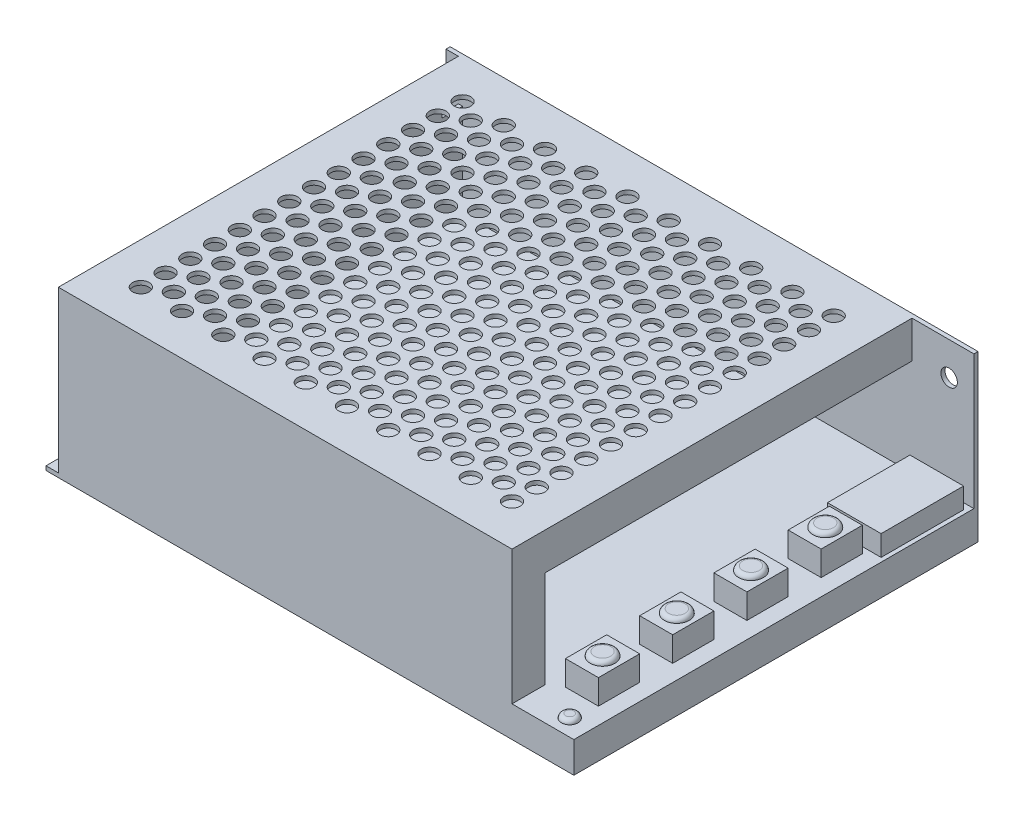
SolidWorks part; units mm, degrees
ref_plane "前视基准面" through (0, 0, 0) normal (0, 0, 1) x (1, 0, 0)
ref_plane "上视基准面" through (0, 0, 0) normal (0, 1, 0) x (1, 0, 0)
ref_plane "右视基准面" through (0, 0, 0) normal (1, 0, 0) x (0, 0, -1)
sketch "草图1" plane through (0, 0, 0) normal (1, 0, 0) x (0, 0, -1)
  line L2 (49, 20) -> (49, -20)
  line L3 (49, -20) -> (-49, -20)
  line L4 (-49, -20) -> (-49, 20)
  line L5 (-49, 20) -> (49, 20)
extrude "凸台-拉伸1" add sketch "草图1" along normal blind 110
ref_plane "基准面1" through (0, -20, 0) normal (0, 1, 0) x (1, 0, 0)
sketch "草图2" plane through (0, -20, 0) normal (0, 1, 0) x (1, 0, 0)
  line L0 (110, -49) -> (125, -49)
  line L1 (125, -49) -> (125, 48)
  line L2 (110, -49) -> (110, 48)
  line L3 (110, -49) -> (110, 49) construction
  line L4 (125, 48) -> (110, 48)
extrude "凸台-拉伸2" add sketch "草图2" along normal blind 7.5
sketch "草图3" plane through (0, -20, 0) normal (0, 1, 0) x (1, 0, 0)
  line L0 (110, 48) -> (110, 49)
  line L1 (110, 49) -> (125, 49)
  line L2 (125, 49) -> (125, 48)
  line L3 (125, 48) -> (110, 48)
extrude "凸台-拉伸3" add sketch "草图3" along normal blind 40
sketch "草图4" plane through (0, -20, 0) normal (0, 1, 0) x (1, 0, 0)
  line L0 (0, 49) -> (0, 48)
  line L1 (0, -49) -> (0, 49) construction
  line L2 (0, -49) -> (0, -36)
  line L3 (0, 48) -> (0, -36)
  line L4 (0, 48) -> (-3, 48)
  line L5 (-3, 48) -> (-3, -36)
  line L6 (-3, -36) -> (0, -36)
extrude "凸台-拉伸4" add sketch "草图4" along normal blind 13 contours L5 L6 L3 L4
sketch "草图5" plane through (0, -20, 0) normal (0, 1, 0) x (1, 0, 0)
  line L0 (0, 49) -> (0, 48)
  line L1 (0, 48) -> (-3, 48)
  line L2 (-3, 48) -> (-3, 49)
  line L3 (-3, 49) -> (0, 49)
sketch "草图6" plane through (0, 0, -48) normal (0, 0, -1) x (-1, 0, 0)
  line L0 (0.6022, -7) -> (3, -7)
  line L1 (0, -7) -> (3, -7) construction
  line L2 (3, -7) -> (3, -10.5)
  line L3 (3, -7) -> (3, -20) construction
  line L4 (0.6022, -7) -> (3, -10.5)
extrude "切除-拉伸2" cut sketch "草图6" against normal blind 84
extrude "凸台-拉伸6" add sketch "草图5" along normal blind 40
sketch "草图7" plane through (0, 0, 0) normal (-1, 0, 0) x (0, 0, 1)
  line L0 (49, -20) -> (36, -20)
  line L1 (36, -20) -> (36, -19)
  line L2 (36, -19) -> (49, -19)
  line L3 (49, 20) -> (49, -20) construction
  line L4 (49, -19) -> (49, -20)
extrude "凸台-拉伸7" add sketch "草图7" along normal blind 3
sketch "草图8" plane through (0, -19, 0) normal (0, 1, 0) x (1, 0, 0)
  line L1 (-2.5, -41.4979) -> (-1.5021, -41.4969)
  line L2 (-3, -49) -> (-3, -36) construction
  line L4 (-3, -36) -> (-3, -43.5015)
  line L5 (-3, -43.5015) -> (-1.5, -43.5031)
  line L7 (-3, -36) -> (-2.5, -36)
  line L8 (-3, -36) -> (0, -36) construction
  line L9 (-2.5, -36) -> (-2.5, -41.4979)
  arc A0 (-1.5021, -43.5031) -> (-1.5021, -41.4969) centre (-1.5, -42.5) ccw
sketch "草图11" plane through (0, 0, -48) normal (0, 0, 1) x (1, 0, 0)
  line L0 (-1.5, 12.0685) -> (-3, 12.0685)
  line L3 (-3, 20) -> (-3, -10.5) construction
  line L4 (-3, 12.0685) -> (-3, 10.0685)
  line L6 (-3, 10.0685) -> (-1.5, 10.0685)
  arc A0 (-1.5, 10.0685) -> (-1.5, 12.0685) centre (-1.5, 11.0685) ccw
sketch "草图12" plane through (0, 0, -48) normal (0, 0, 1) x (1, 0, 0)
  circle A0 centre (119, 12) radius 2
extrude "切除-拉伸7" cut sketch "草图12" against normal blind 1
sketch "草图14" plane through (0, -12.5, 0) normal (0, 1, 0) x (1, 0, 0)
  line L10 (112.969, -29.0094) -> (120.969, -29.0094)
  line L11 (120.969, -29.0094) -> (120.969, -39.0094)
  line L12 (120.969, -39.0094) -> (112.969, -39.0094)
  line L13 (112.969, -39.0094) -> (112.969, -29.0094)
  line L16 (112.969, -21.0094) -> (120.969, -21.0094)
  line L17 (120.969, -21.0094) -> (120.969, -11.0094)
  line L18 (120.969, -11.0094) -> (112.969, -11.0094)
  line L19 (112.969, -11.0094) -> (112.969, -21.0094)
  line L20 (112.969, -3.0094) -> (120.969, -3.0094)
  line L21 (120.969, -3.0094) -> (120.969, 6.9906)
  line L22 (120.969, 6.9906) -> (112.969, 6.9906)
  line L23 (112.969, 6.9906) -> (112.969, -3.0094)
  line L24 (112.969, 14.9906) -> (120.969, 14.9906)
  line L25 (120.969, 14.9906) -> (120.969, 24.9906)
  line L26 (120.969, 24.9906) -> (112.969, 24.9906)
  line L27 (112.969, 24.9906) -> (112.969, 14.9906)
  circle A0 centre (120, -46) radius 2
extrude "凸台-拉伸10" add sketch "草图14" along normal blind 6 contours L13 L12 L11 L10 | L18 L19 L16 L17 | L22 L23 L20 L21 | L26 L27 L24 L25
sketch "草图15" plane through (0, -6.5, 0) normal (0, 1, 0) x (1, 0, 0)
  circle A0 centre (116.9739, -34.0094) radius 3
  circle A1 centre (116.9739, -16.0094) radius 3
  circle A2 centre (116.9739, 1.9906) radius 3
  circle A3 centre (116.9739, 19.9906) radius 3
extrude "凸台-拉伸12" add sketch "草图15" along normal blind 1
fillet "圆角5" radius 1 1 edges at (116.9739, -5.5, 37.0094)
fillet "圆角6" radius 1 3 edges at (116.9739, -5.5, -16.9906) (116.9739, -5.5, 1.0094) (116.9739, -5.5, 19.0094)
sketch "草图16" plane through (0, -12.5, 0) normal (0, 1, 0) x (1, 0, 0)
  circle A0 centre (120, -45) radius 2
extrude "凸台-拉伸13" add sketch "草图16" along normal blind 1 contours A0
fillet "圆角11" radius 1 1 edges at (120, -11.5, 47)
extrude "切除-拉伸8" cut sketch "草图8" against normal blind 1 contours L5 A0 L1 L9 M6 M7
extrude "切除-拉伸9" cut sketch "草图11" against normal blind 1
sketch "草图18" plane through (0, -20, 0) normal (0, -1, 0) x (1, 0, 0)
  circle A0 centre (120, 45) radius 2
  point P1 (120, 45)
hole_wizard "M4 螺纹孔1" positions "3D草图2" profile "草图20" tap size "M4" standard "GB"
sketch3d "3D草图2"
  point P0 (120, -20, 45)
sketch "草图20" plane through (120, -20, 45) normal (1, 0, 0) x (0, 0, -1)
  line L0 (0, 0) -> (0, 4.9914)
  line L1 (0, 4.9914) -> (1.65, 4)
  line L2 (1.65, 4) -> (1.65, 0)
  line L5 (1.65, 0) -> (0, 0)
  line L10 (0, 4.9914) -> (-1.65, 4) construction
  line L11 (0, -6.35) -> (0, 107.95) construction
  dimension "螺纹孔钻头直径" = 3.3
  dimension "螺纹孔钻头深度" = 4
  dimension "导头角度" = 118
sketch "草图21" plane through (0, -20, 0) normal (0, -1, 0) x (1, 0, 0)
  point P7 (7, 45)
hole_wizard "M4 螺纹孔2" positions "3D草图3" profile "草图22" tap size "M4" standard "GB"
sketch3d "3D草图3"
  point P0 (7, -20, 45)
sketch "草图22" plane through (7, -20, 45) normal (1, 0, 0) x (0, 0, -1)
  line L0 (0, 0) -> (0, 8.4914)
  line L1 (0, 8.4914) -> (1.65, 7.5)
  line L2 (1.65, 7.5) -> (1.65, 0)
  line L5 (1.65, 0) -> (0, 0)
  line L10 (0, 8.4914) -> (-1.65, 7.5) construction
  line L11 (0, -6.35) -> (0, 107.95) construction
  dimension "螺纹孔钻头直径" = 3.3
  dimension "螺纹孔钻头深度" = 7.5
  dimension "导头角度" = 118
sketch "草图23" plane through (0, 20, 0) normal (0, 1, 0) x (1, 0, 0)
  circle A0 centre (10, -39) radius 2
  circle A1 centre (10, -33) radius 2
  circle A2 centre (20, -33) radius 2
  circle A3 centre (20, -39) radius 2
  circle A4 centre (30, -33) radius 2
  circle A5 centre (30, -39) radius 2
  circle A6 centre (40, -33) radius 2
  circle A7 centre (40, -39) radius 2
  circle A8 centre (50, -33) radius 2
  circle A9 centre (50, -39) radius 2
  circle A10 centre (60, -33) radius 2
  circle A11 centre (60, -39) radius 2
  circle A12 centre (70, -33) radius 2
  circle A13 centre (70, -39) radius 2
  circle A14 centre (80, -33) radius 2
  circle A15 centre (80, -39) radius 2
  circle A16 centre (90, -33) radius 2
  circle A17 centre (90, -39) radius 2
  circle A18 centre (100, -33) radius 2
  circle A19 centre (100, -39) radius 2
  circle A20 centre (10, -27) radius 2
  circle A21 centre (20, -33) radius 2
  circle A22 centre (30, -33) radius 2
  circle A23 centre (40, -33) radius 2
  circle A24 centre (50, -33) radius 2
  circle A25 centre (60, -33) radius 2
  circle A26 centre (70, -33) radius 2
  circle A27 centre (80, -33) radius 2
  circle A28 centre (90, -33) radius 2
  circle A29 centre (100, -33) radius 2
  circle A30 centre (10, -21) radius 2
  circle A31 centre (20, -27) radius 2
  circle A32 centre (30, -27) radius 2
  circle A33 centre (40, -27) radius 2
  circle A34 centre (50, -27) radius 2
  circle A35 centre (60, -27) radius 2
  circle A36 centre (70, -27) radius 2
  circle A37 centre (80, -27) radius 2
  circle A38 centre (90, -27) radius 2
  circle A39 centre (100, -27) radius 2
  circle A40 centre (10, -15) radius 2
  circle A41 centre (20, -21) radius 2
  circle A42 centre (30, -21) radius 2
  circle A43 centre (40, -21) radius 2
  circle A44 centre (50, -21) radius 2
  circle A45 centre (60, -21) radius 2
  circle A46 centre (70, -21) radius 2
  circle A47 centre (80, -21) radius 2
  circle A48 centre (90, -21) radius 2
  circle A49 centre (100, -21) radius 2
  circle A50 centre (10, -9) radius 2
  circle A51 centre (20, -15) radius 2
  circle A52 centre (30, -15) radius 2
  circle A53 centre (40, -15) radius 2
  circle A54 centre (50, -15) radius 2
  circle A55 centre (60, -15) radius 2
  circle A56 centre (70, -15) radius 2
  circle A57 centre (80, -15) radius 2
  circle A58 centre (90, -15) radius 2
  circle A59 centre (100, -15) radius 2
  circle A60 centre (10, -3) radius 2
  circle A61 centre (20, -9) radius 2
  circle A62 centre (30, -9) radius 2
  circle A63 centre (40, -9) radius 2
  circle A64 centre (50, -9) radius 2
  circle A65 centre (60, -9) radius 2
  circle A66 centre (70, -9) radius 2
  circle A67 centre (80, -9) radius 2
  circle A68 centre (90, -9) radius 2
  circle A69 centre (100, -9) radius 2
  circle A70 centre (10, 3) radius 2
  circle A71 centre (20, -3) radius 2
  circle A72 centre (30, -3) radius 2
  circle A73 centre (40, -3) radius 2
  circle A74 centre (50, -3) radius 2
  circle A75 centre (60, -3) radius 2
  circle A76 centre (70, -3) radius 2
  circle A77 centre (80, -3) radius 2
  circle A78 centre (90, -3) radius 2
  circle A79 centre (100, -3) radius 2
  circle A80 centre (10, 9) radius 2
  circle A81 centre (20, 3) radius 2
  circle A82 centre (30, 3) radius 2
  circle A83 centre (40, 3) radius 2
  circle A84 centre (50, 3) radius 2
  circle A85 centre (60, 3) radius 2
  circle A86 centre (70, 3) radius 2
  circle A87 centre (80, 3) radius 2
  circle A88 centre (90, 3) radius 2
  circle A89 centre (100, 3) radius 2
  circle A90 centre (10, 15) radius 2
  circle A91 centre (20, 9) radius 2
  circle A92 centre (30, 9) radius 2
  circle A93 centre (40, 9) radius 2
  circle A94 centre (50, 9) radius 2
  circle A95 centre (60, 9) radius 2
  circle A96 centre (70, 9) radius 2
  circle A97 centre (80, 9) radius 2
  circle A98 centre (90, 9) radius 2
  circle A99 centre (100, 9) radius 2
  circle A100 centre (10, 21) radius 2
  circle A101 centre (20, 15) radius 2
  circle A102 centre (30, 15) radius 2
  circle A103 centre (40, 15) radius 2
  circle A104 centre (50, 15) radius 2
  circle A105 centre (60, 15) radius 2
  circle A106 centre (70, 15) radius 2
  circle A107 centre (80, 15) radius 2
  circle A108 centre (90, 15) radius 2
  circle A109 centre (100, 15) radius 2
  circle A110 centre (10, 27) radius 2
  circle A111 centre (20, 21) radius 2
  circle A112 centre (30, 21) radius 2
  circle A113 centre (40, 21) radius 2
  circle A114 centre (50, 21) radius 2
  circle A115 centre (60, 21) radius 2
  circle A116 centre (70, 21) radius 2
  circle A117 centre (80, 21) radius 2
  circle A118 centre (90, 21) radius 2
  circle A119 centre (100, 21) radius 2
  circle A120 centre (10, 33) radius 2
  circle A121 centre (20, 27) radius 2
  circle A122 centre (30, 27) radius 2
  circle A123 centre (40, 27) radius 2
  circle A124 centre (50, 27) radius 2
  circle A125 centre (60, 27) radius 2
  circle A126 centre (70, 27) radius 2
  circle A127 centre (80, 27) radius 2
  circle A128 centre (90, 27) radius 2
  circle A129 centre (100, 27) radius 2
  circle A130 centre (10, 39) radius 2
  circle A131 centre (20, 33) radius 2
  circle A132 centre (30, 33) radius 2
  circle A133 centre (40, 33) radius 2
  circle A134 centre (50, 33) radius 2
  circle A135 centre (60, 33) radius 2
  circle A136 centre (70, 33) radius 2
  circle A137 centre (80, 33) radius 2
  circle A138 centre (90, 33) radius 2
  circle A139 centre (100, 33) radius 2
  circle A140 centre (95, -36) radius 2
  circle A141 centre (20, 39) radius 2
  circle A142 centre (30, 39) radius 2
  circle A143 centre (40, 39) radius 2
  circle A144 centre (50, 39) radius 2
  circle A145 centre (60, 39) radius 2
  circle A146 centre (70, 39) radius 2
  circle A147 centre (80, 39) radius 2
  circle A148 centre (90, 39) radius 2
  circle A149 centre (100, 39) radius 2
  circle A151 centre (85, -36) radius 2
  circle A152 centre (75, -36) radius 2
  circle A153 centre (65, -36) radius 2
  circle A154 centre (55, -36) radius 2
  circle A155 centre (45, -36) radius 2
  circle A156 centre (35, -36) radius 2
  circle A157 centre (25, -36) radius 2
  circle A158 centre (15, -36) radius 2
  circle A159 centre (95, -30) radius 2
  circle A160 centre (85, -30) radius 2
  circle A161 centre (75, -30) radius 2
  circle A162 centre (65, -30) radius 2
  circle A163 centre (55, -30) radius 2
  circle A164 centre (45, -30) radius 2
  circle A165 centre (35, -30) radius 2
  circle A166 centre (25, -30) radius 2
  circle A167 centre (15, -30) radius 2
  circle A168 centre (95, -24) radius 2
  circle A169 centre (85, -24) radius 2
  circle A170 centre (75, -24) radius 2
  circle A171 centre (65, -24) radius 2
  circle A172 centre (55, -24) radius 2
  circle A173 centre (45, -24) radius 2
  circle A174 centre (35, -24) radius 2
  circle A175 centre (25, -24) radius 2
  circle A176 centre (15, -24) radius 2
  circle A177 centre (95, -18) radius 2
  circle A178 centre (85, -18) radius 2
  circle A179 centre (75, -18) radius 2
  circle A180 centre (65, -18) radius 2
  circle A181 centre (55, -18) radius 2
  circle A182 centre (45, -18) radius 2
  circle A183 centre (35, -18) radius 2
  circle A184 centre (25, -18) radius 2
  circle A185 centre (15, -18) radius 2
  circle A186 centre (95, -12) radius 2
  circle A187 centre (85, -12) radius 2
  circle A188 centre (75, -12) radius 2
  circle A189 centre (65, -12) radius 2
  circle A190 centre (55, -12) radius 2
  circle A191 centre (45, -12) radius 2
  circle A192 centre (35, -12) radius 2
  circle A193 centre (25, -12) radius 2
  circle A194 centre (15, -12) radius 2
  circle A195 centre (95, -6) radius 2
  circle A196 centre (85, -6) radius 2
  circle A197 centre (75, -6) radius 2
  circle A198 centre (65, -6) radius 2
  circle A199 centre (55, -6) radius 2
  circle A200 centre (45, -6) radius 2
  circle A201 centre (35, -6) radius 2
  circle A202 centre (25, -6) radius 2
  circle A203 centre (15, -6) radius 2
  circle A204 centre (95, 0) radius 2
  circle A205 centre (85, 0) radius 2
  circle A206 centre (75, 0) radius 2
  circle A207 centre (65, 0) radius 2
  circle A208 centre (55, 0) radius 2
  circle A209 centre (45, 0) radius 2
  circle A210 centre (35, 0) radius 2
  circle A211 centre (25, 0) radius 2
  circle A212 centre (15, 0) radius 2
  circle A213 centre (95, 6) radius 2
  circle A214 centre (85, 6) radius 2
  circle A215 centre (75, 6) radius 2
  circle A216 centre (65, 6) radius 2
  circle A217 centre (55, 6) radius 2
  circle A218 centre (45, 6) radius 2
  circle A219 centre (35, 6) radius 2
  circle A220 centre (25, 6) radius 2
  circle A221 centre (15, 6) radius 2
  circle A222 centre (95, 12) radius 2
  circle A223 centre (85, 12) radius 2
  circle A224 centre (75, 12) radius 2
  circle A225 centre (65, 12) radius 2
  circle A226 centre (55, 12) radius 2
  circle A227 centre (45, 12) radius 2
  circle A228 centre (35, 12) radius 2
  circle A229 centre (25, 12) radius 2
  circle A230 centre (15, 12) radius 2
  circle A231 centre (95, 18) radius 2
  circle A232 centre (85, 18) radius 2
  circle A233 centre (75, 18) radius 2
  circle A234 centre (65, 18) radius 2
  circle A235 centre (55, 18) radius 2
  circle A236 centre (45, 18) radius 2
  circle A237 centre (35, 18) radius 2
  circle A238 centre (25, 18) radius 2
  circle A239 centre (15, 18) radius 2
  circle A240 centre (95, 24) radius 2
  circle A241 centre (85, 24) radius 2
  circle A242 centre (75, 24) radius 2
  circle A243 centre (65, 24) radius 2
  circle A244 centre (55, 24) radius 2
  circle A245 centre (45, 24) radius 2
  circle A246 centre (35, 24) radius 2
  circle A247 centre (25, 24) radius 2
  circle A248 centre (15, 24) radius 2
  circle A249 centre (95, 30) radius 2
  circle A250 centre (85, 30) radius 2
  circle A251 centre (75, 30) radius 2
  circle A252 centre (65, 30) radius 2
  circle A253 centre (55, 30) radius 2
  circle A254 centre (45, 30) radius 2
  circle A255 centre (35, 30) radius 2
  circle A256 centre (25, 30) radius 2
  circle A257 centre (15, 30) radius 2
  circle A258 centre (95, 36) radius 2
  circle A259 centre (85, 36) radius 2
  circle A260 centre (75, 36) radius 2
  circle A261 centre (65, 36) radius 2
  circle A262 centre (55, 36) radius 2
  circle A263 centre (45, 36) radius 2
  circle A264 centre (35, 36) radius 2
  circle A265 centre (25, 36) radius 2
  circle A266 centre (15, 36) radius 2
  dimension "D1" = 10
  dimension "D6" = 9
  dimension "D3" = 14
  dimension "D7" = 13
extrude "切除-拉伸10" cut sketch "草图23" against normal blind 1
sketch "草图24" plane through (110, 0, 0) normal (1, 0, 0) x (0, 0, -1)
  line L1 (48, -12.5) -> (-49, -12.5) construction
  line L2 (-41, -12.5) -> (-41, 19)
  line L5 (48, 19) -> (48, -12.5)
  line L6 (48, -12.5) -> (-41, -12.5)
  line L7 (-41, 19) -> (48, 19)
extrude "切除-拉伸11" cut sketch "草图24" against normal blind 109
ref_plane "基准面2" through (110, 0, 0) normal (1, 0, 0) x (0, 0, -1)
sketch "草图25" plane through (110, 0, 0) normal (1, 0, 0) x (0, 0, -1)
  line L0 (-41, 19) -> (-41, 11)
  line L1 (-41, 19) -> (-41, -12.5) construction
  line L2 (-41, 19) -> (48, 19)
  line L3 (48, 19) -> (48, 11)
  line L4 (48, 11) -> (-41, 11)
extrude "凸台-拉伸14" add sketch "草图25" against normal blind 1
sketch "草图26" plane through (0, -12.5, 0) normal (0, 1, 0) x (1, 0, 0)
  line L3 (124, 46.5) -> (124, 26.5)
  line L4 (124, 26.5) -> (111, 26.5)
  line L5 (111, 26.5) -> (111, 46.5)
  line L6 (111, 46.5) -> (124, 46.5)
extrude "凸台-拉伸15" add sketch "草图26" along normal blind 5
sketch "草图28" plane through (0, 0, 0) normal (-1, 0, 0) x (0, 0, 1)
  line L0 (48.5081, -19) -> (48.5081, -11)
  line L2 (48.5081, -11) -> (37, -11)
  line L3 (37, -11) -> (37, -7)
  line L4 (36, -7) -> (37, -7)
  line L5 (36, -7) -> (36, -19)
  line L6 (36, -19) -> (48.5081, -19)
  line L9 (-43, 18.9575) -> (-43, 10)
  line L10 (-43, 10) -> (-48, 10)
  line L11 (-48, 20) -> (-48, -7) construction
  line L12 (-48, 10) -> (-48, 18.9575)
  line L14 (-43, 18.9575) -> (-48, 18.9575)
extrude "切除-拉伸15" cut sketch "草图28" against normal blind 5
sketch "草图29" plane through (0, 0, 0) normal (-1, 0, 0) x (0, 0, 1)
  circle A0 centre (42.7541, -3) radius 2
extrude "凸台-拉伸16" add sketch "草图29" along normal blind 1 contours A0
fillet "圆角12" radius 1 1 edges at (-1, -3, 44.7541)
